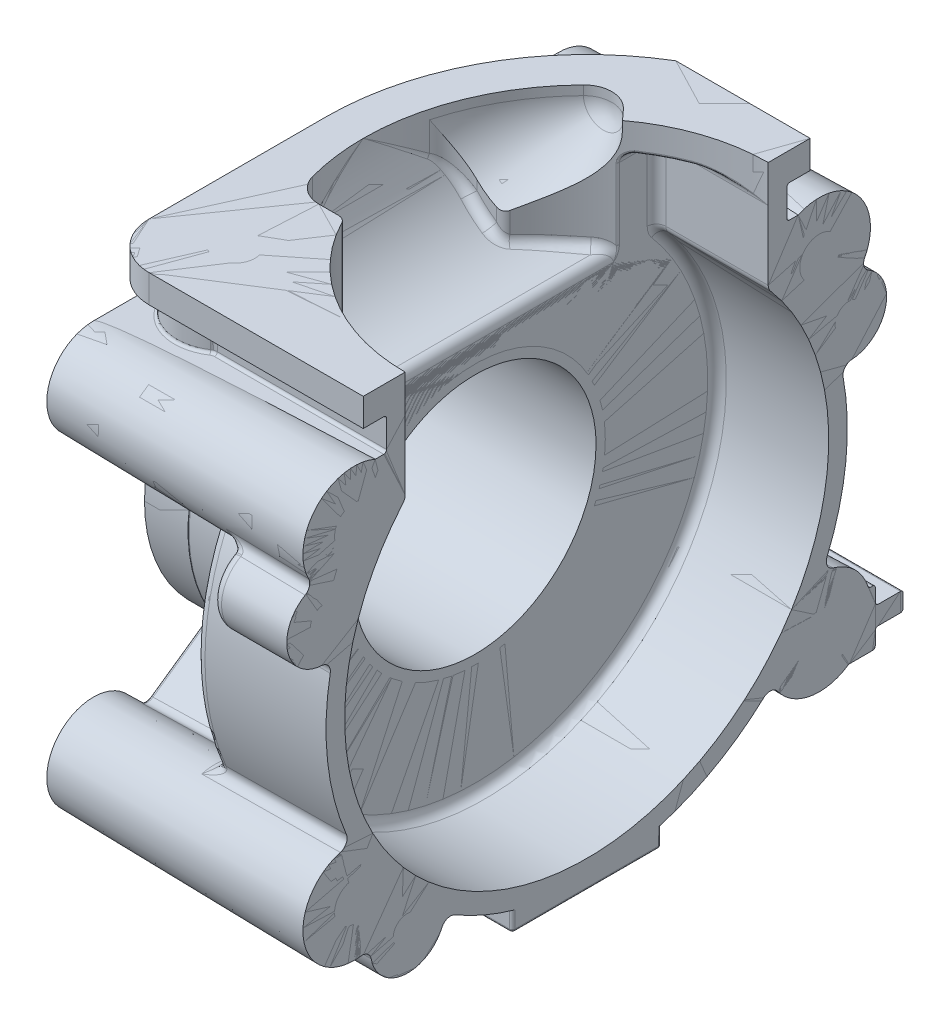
SolidWorks part; units mm, degrees
ref_plane "Plan de face" through (0, 0, 0) normal (0, 0, 1) x (1, 0, 0)
ref_plane "Plan de dessus" through (0, 0, 0) normal (0, 1, 0) x (1, 0, 0)
ref_plane "Plan de droite" through (0, 0, 0) normal (1, 0, 0) x (0, 0, -1)
imported_body "Importée1"
sketch "Esquisse1" plane through (0, 0, 0) normal (1, 0, 0) x (0, 0, -1)
  circle A0 centre (0, 0) radius 14
  dimension "D1" = 28
extrude "MiP_Radiale-Rlt" cut sketch "Esquisse1" against normal through all
ref_plane "Plan4" through (-20.65, 0, 0) normal (1, 0, 0) x (0, 0, -1)
sketch "Esquisse2" plane through (-20.65, 0, 0) normal (1, 0, 0) x (0, 0, -1)
  circle A0 centre (0, 0) radius 14.7
  dimension "D1" = 29.4
extrude "Enlèv. mat.-Extru.2" cut sketch "Esquisse2" along normal blind 1.3
sketch "Esquisse3" plane through (0, 0, 0) normal (1, 0, 0) x (0, 0, -1)
  line L0 (-28.1908, 10.2606) -> (0, 0) construction
  line L1 (0, 0) -> (-19.2836, -22.9813) construction
  line L2 (0, 0) -> (28.1908, 10.2606) construction
  line L3 (0, 17.1158) -> (0, -17.1158) construction
  circle A0 centre (-28.1908, 10.2606) radius 1.5
  circle A1 centre (28.1908, 10.2606) radius 1.5
  circle A2 centre (-19.2836, -22.9813) radius 1.5
  circle A6 centre (0, 0) radius 30 construction
  dimension "D1" = 3
  dimension "D2" = 60
  dimension "D3" = 70
  dimension "D4" = 140
  dimension "D5" = 70
extrude "MiP_Carter-FG" cut sketch "Esquisse3" against normal blind 3
sketch "Esquisse4" plane through (0, 0, 0) normal (1, 0, 0) x (0, 0, -1)
  line L0 (-24.9841, -17.4941) -> (24.9841, 17.4941) construction
  line L1 (-24.9841, 17.4941) -> (24.9841, -17.4941) construction
  line L2 (0, 0) -> (-28.1908, 10.2606) construction
  circle A0 centre (-24.9841, 17.4941) radius 2.1
  circle A1 centre (24.9841, 17.4941) radius 2.1
  circle A2 centre (-24.9841, -17.4941) radius 2.1
  circle A3 centre (24.9841, -17.4941) radius 2.1
  circle A4 centre (-28.1908, 10.2606) radius 1.5 construction
  circle A8 centre (0, 0) radius 30.5 construction
  dimension "D1" = 4.2
  dimension "D2" = 61
  dimension "D3" = 15
  dimension "D4" = 70
extrude "MaP_Carter-FG" cut sketch "Esquisse4" against normal through all
sketch "Esquisse5" plane through (0, 29, 0) normal (0, 1, 0) x (-1, 0, 0)
  line L0 (17.1158, 0) -> (-17.1158, 0) construction
  line L1 (0, 31.9265) -> (0, -31.9265) construction
  circle A0 centre (20.75, 17) radius 2.1
  dimension "D1" = 4.2
  dimension "D3" = 20.75
  dimension "D2" = 17
extrude "Map_Cyl" cut sketch "Esquisse5" against normal up to surface (14.4053 mm away)
